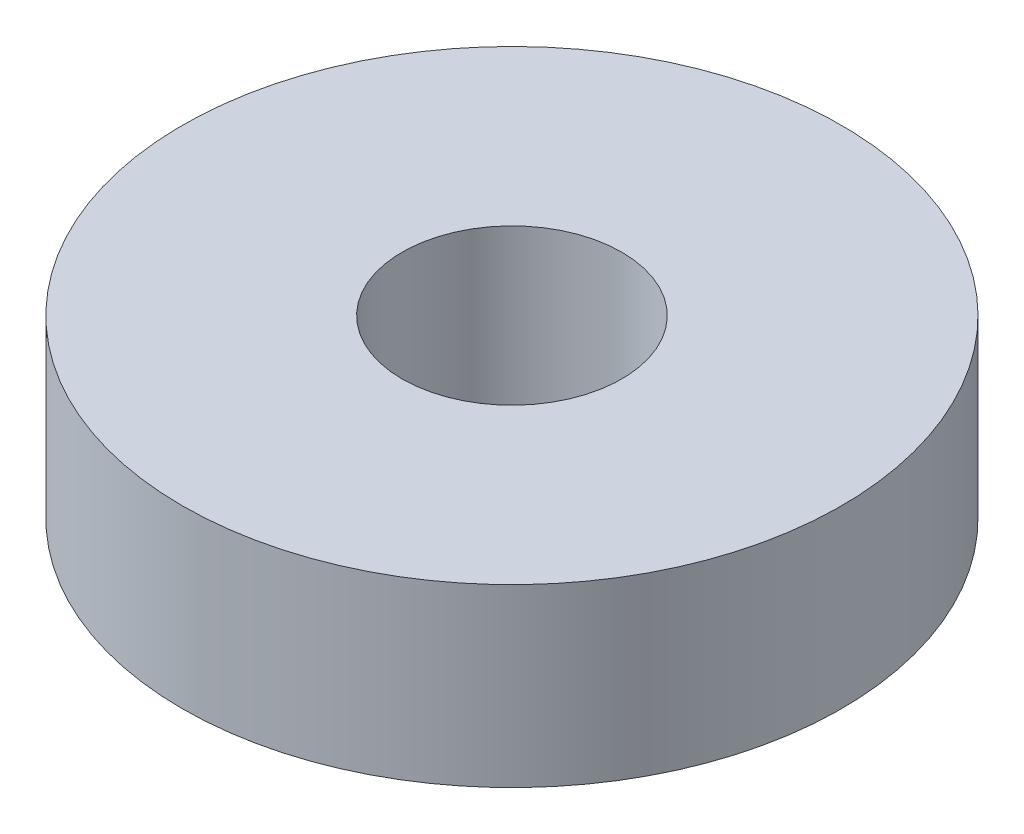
SolidWorks part; units mm, degrees
ref_plane "Спереди" through (0, 0, 0) normal (0, 0, 1) x (1, 0, 0)
ref_plane "Сверху" through (0, 0, 0) normal (0, 1, 0) x (1, 0, 0)
ref_plane "Справа" through (0, 0, 0) normal (1, 0, 0) x (0, 0, -1)
sketch "Эскиз1" plane through (0, 0, 0) normal (0, 1, 0) x (1, 0, 0)
  circle A0 centre (0, 0) radius 7.5
  circle A1 centre (0, 0) radius 2.5
  dimension "D1" = 5
  dimension "D2" = 15
extrude "Бобышка-Вытянуть1" add sketch "Эскиз1" along normal blind 4
